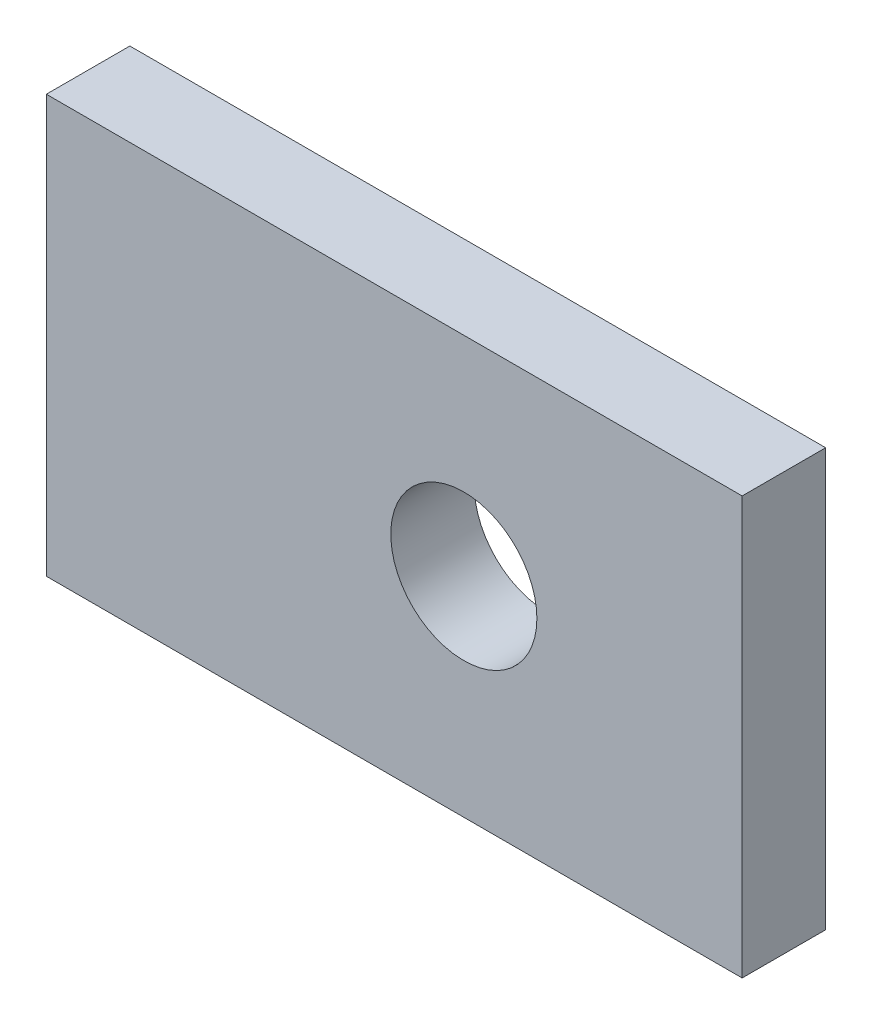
SolidWorks part; units mm, degrees
ref_plane "Face" through (0, 0, 0) normal (0, 0, 1) x (1, 0, 0)
ref_plane "Dessus" through (0, 0, 0) normal (0, 1, 0) x (1, 0, 0)
ref_plane "Droite" through (0, 0, 0) normal (1, 0, 0) x (0, 0, -1)
sketch "Esquisse1" plane through (0, 0, 0) normal (0, 0, 1) x (1, 0, 0)
  line L1 (0, 0) -> (100, 0)
  line L2 (0, 0) -> (0, 60)
  line L3 (0, 60) -> (100, 60)
  line L4 (100, 0) -> (100, 60)
  circle A0 centre (60, 30) radius 10.5
  dimension "D3" = 21
  dimension "D1" = 60
  dimension "D2" = 100
  dimension "D4" = 60
  dimension "D5" = 30
extrude "Base-Extrusion" add sketch "Esquisse1" along normal blind 12
sketch "Esquisse2" plane through (0, 0, 0) normal (-1, 0, 0) x (0, 0, 1)
  line L0 (0, 37.5) -> (-5.7333, 33.2)
  line L2 (-5.7333, 26.8) -> (0, 22.5)
  line L3 (0, 37.5) -> (0, 22.5)
  line L4 (-10, 30) -> (6.9179, 30) construction
  line L5 (12, 60) -> (0, 60) construction
  line L6 (0, 60) -> (0, 0) construction
  arc A0 (-5.7333, 26.8) -> (-5.7333, 33.2) centre (-3.3333, 30) cw
  dimension "D4" = 4
  dimension "D1" = 10
  dimension "D2" = 30
  dimension "D3" = 15
extrude "Extrusion1" add sketch "Esquisse2" against normal blind 20
chamfer "Chanfrein1" distance 6 angle 45 1 edges at (20, 30, 0)
